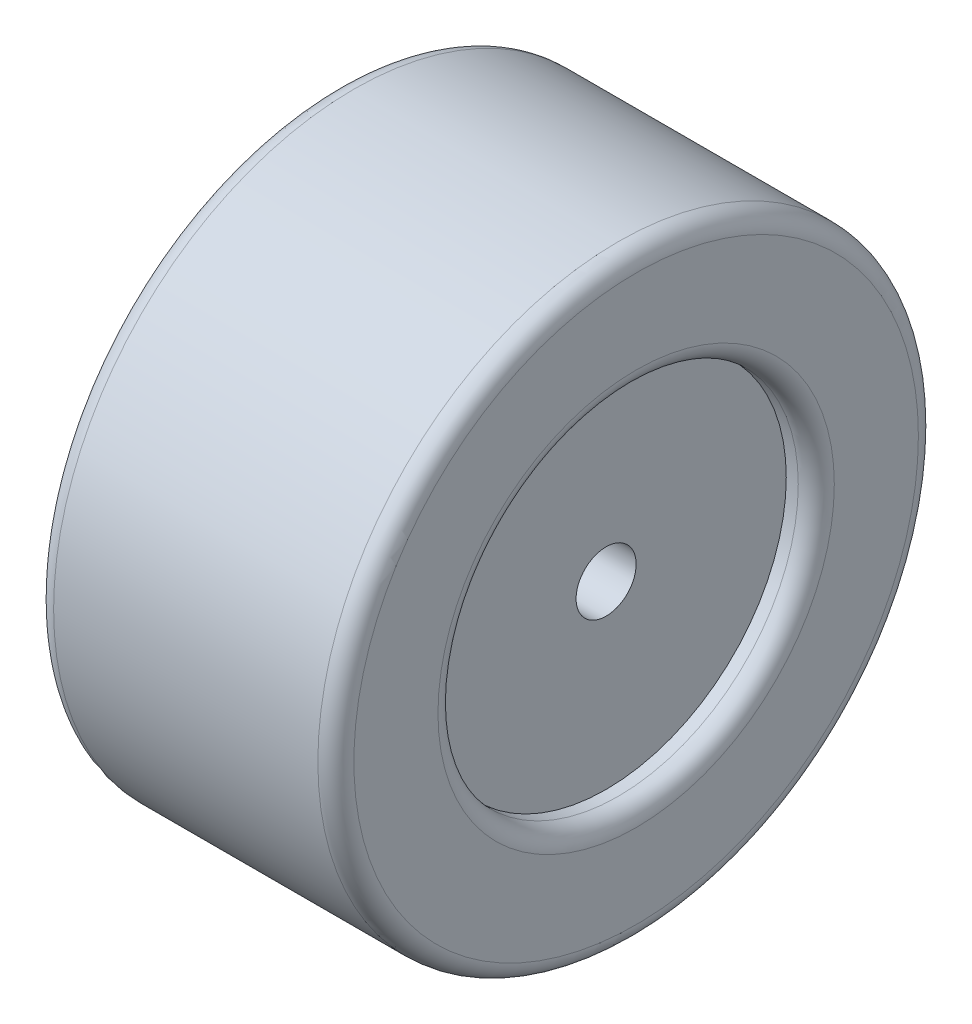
SolidWorks part; units mm, degrees
ref_plane "Plan de face" through (0, 0, 0) normal (0, 0, 1) x (1, 0, 0)
ref_plane "Plan de dessus" through (0, 0, 0) normal (0, 1, 0) x (1, 0, 0)
ref_plane "Plan de droite" through (0, 0, 0) normal (1, 0, 0) x (0, 0, -1)
sketch "Esquisse1" plane through (0, 0, 0) normal (1, 0, 0) x (0, 0, -1)
  circle A0 centre (0, 0) radius 5
  circle A1 centre (0, 0) radius 0.5
extrude "Boss.-Extru.1" add sketch "Esquisse1" along normal blind 5
sketch "Esquisse2" plane through (5, 0, 0) normal (1, 0, 0) x (0, 0, -1)
  circle A0 centre (0, 0) radius 3
extrude "Enlèv. mat.-Extru.1" cut sketch "Esquisse2" against normal blind 0.5
sketch "Esquisse3" plane through (0, 0, 0) normal (-1, 0, 0) x (0, 0, 1)
  circle A0 centre (0, 0) radius 3
extrude "Enlèv. mat.-Extru.2" cut sketch "Esquisse3" against normal blind 0.5
fillet "Congé1" radius 0.3 4 edges at (5, 0, -3) (0, 0, 3) (5, 0, -5) (0, 0, -5)
